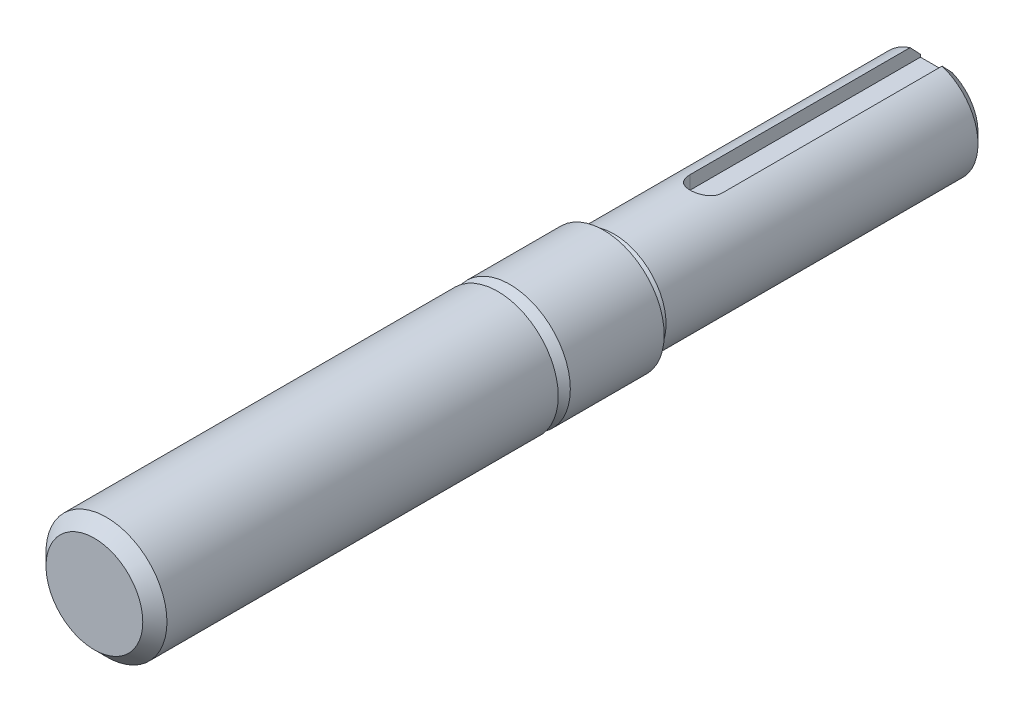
SolidWorks part; units mm, degrees
ref_plane "Front" through (0, 0, 0) normal (0, 0, 1) x (1, 0, 0)
ref_plane "Top" through (0, 0, 0) normal (0, 1, 0) x (1, 0, 0)
ref_plane "Right" through (0, 0, 0) normal (1, 0, 0) x (0, 0, -1)
sketch "Sketch1" plane through (0, 0, 0) normal (1, 0, 0) x (0, 0, -1)
  line L0 (0, 0) -> (65.3053, 0) construction
  line L1 (0, 0) -> (0, 4.8016)
  line L2 (0, 4.8016) -> (1.2004, 6.002)
  line L3 (1.2004, 6.002) -> (40.0304, 6.002)
  line L4 (40.0304, 6.002) -> (40.0304, 4.8016)
  line L5 (40.0304, 4.8016) -> (41.2308, 6.002)
  line L6 (41.2308, 6.002) -> (50.546, 6.002)
  line L7 (50.546, 6.002) -> (50.546, 4.6406)
  line L8 (50.546, 4.6406) -> (51.5772, 5.1562)
  line L9 (51.5772, 5.1562) -> (82.5348, 5.1562)
  line L10 (82.5348, 5.1562) -> (83.566, 4.125)
  line L11 (83.566, 4.125) -> (83.566, 0)
  line L12 (0, 0) -> (83.566, 0)
  dimension "D" = 12.004
  dimension "DChamp1" = 1.2004
  dimension "DChamp2" = 1.2004
  dimension "E" = 40.0304
  dimension "DChamp4" = 1.2004
  dimension "DChamp3" = 1.2004
  dimension "B" = 50.546
  dimension "CChamp1" = 1.0312
  dimension "A" = 83.566
  dimension "CChamp3" = 1.0312
  dimension "CChamp4" = 1.0312
  dimension "C" = 10.3124
  dimension "D2" = 12.004
  dimension "CChamp5" = 9.2812
revolve "Revolve1" add sketch "Sketch1" angle 360 about L0
sketch "Sketch2" plane through (0, 0, -50.546) normal (0, 0, -1) x (-1, 0, 0)
  circle A0 centre (0, 0) radius 53.975
  dimension "D1" = 107.95
extrude "Type123-N" [suppressed] cut sketch "Sketch2" along normal through all
sketch "123KeyDepth" plane through (0, 0, -83.566) normal (0, 0, -1) x (-1, 0, 0)
  line L0 (0, 0) -> (0, 3.5687) construction
  line L1 (-0.5766, 3.5687) -> (0.5714, 3.5687) construction
  dimension "KeyDepth" = 3.5687
ref_plane "123Plane" through (0, 3.5687, 0) normal (0, -1, 0) x (1, 0, 0)
sketch "Sketch4" plane through (0, 3.5687, 0) normal (0, -1, 0) x (1, 0, 0)
  line L0 (0.0026, -83.566) -> (0.0026, -38.0533) construction
  line L1 (0.5766, -83.566) -> (-0.5714, -83.566) construction
  line L2 (1.5901, -83.566) -> (1.5901, -60.706)
  line L3 (-1.5849, -60.706) -> (-1.5849, -83.566)
  line L5 (-3.9689, -60.706) -> (2.9563, -60.706) construction
  line L6 (-4.125, -83.566) -> (4.125, -83.566) construction
  line L7 (-1.5849, -83.566) -> (1.5901, -83.566)
  arc A0 (1.5901, -60.706) -> (-1.5849, -60.706) centre (0.0026, -60.706) ccw
  dimension "F" = 3.175
  dimension "G" = 22.86
extrude "123Key" cut sketch "Sketch4" against normal through all
sketch "Sketch5" plane through (0, 0, -40.0304) normal (0, 0, -1) x (-1, 0, 0)
  circle A0 centre (0, 0) radius 63.5
  dimension "D1" = 127
extrude "Type4" [suppressed] cut sketch "Sketch5" along normal through all
chamfer "Type4-Chamfer" [suppressed] distance 2.54 angle 45
sketch "4KeyDepth" [suppressed] plane through (0, 0, -72.136) normal (0, 0, -1) x (-1, 0, 0)
  line L0 (0, 0) -> (0, 9.525) construction
  line L1 (-17.7759, 9.525) -> (18.3619, 9.525) construction
  dimension "Type4KeyDepth" = 4.732
ref_plane "4Plane" [suppressed] through (0, 9.525, 0) normal (0, -1, 0) x (1, 0, 0)
sketch "Sketch7" [suppressed] plane through (0, 9.525, 0) normal (0, -1, 0) x (1, 0, 0)
  line L0 (-0.293, -72.136) -> (-0.293, -158.7004) construction
  line L1 (17.7759, -72.136) -> (-18.3619, -72.136) construction
  line L2 (2.882, -72.136) -> (2.882, -32.0291)
  line L3 (-3.468, -72.136) -> (-3.468, -32.0291)
  line L4 (-3.468, -72.136) -> (2.882, -72.136)
  line L5 (-10.16, -72.136) -> (10.16, -72.136) construction
  line L6 (-10.16, -72.136) -> (10.16, -72.136) construction
  arc A0 (2.882, -32.0291) -> (-3.468, -32.0291) centre (-0.293, -34.036) ccw
  dimension "4F" = 2.54
  dimension "4G" = 2.54
  dimension "4F2" = 1.27
extrude "4Key" [suppressed] cut sketch "Sketch7" against normal through all
equation "\"DChamp3@Sketch1\"=.1*\"D@Sketch1\""
equation "\"DChamp1@Sketch1\"=.1*\"D@Sketch1\""
equation "\"DChamp2@Sketch1\"=.1*\"D@Sketch1\""
equation "\"DChamp4@Sketch1\"=.1*\"D@Sketch1\""
equation "\"CChamp1@Sketch1\"=.1*\"C@Sketch1\""
equation "\"CChamp5@Sketch1\"=.9*\"C@Sketch1\""
equation "\"CChamp3@Sketch1\"=.1*\"C@Sketch1\""
equation "\"CChamp4@Sketch1\"=.1*\"C@Sketch1\""
equation "\"D2@Sketch1\"=\"D@Sketch1\""
equation "\"KeyDepth@123KeyDepth\"=(\"C@Sketch1\"/2)-(\"F@Sketch4\"/2)"
equation "\"Type4KeyDepth@4KeyDepth\"=(\"D@Sketch1\"/2)-(\"4F@Sketch7\"/2)"
equation "\"4F2@Sketch7\"=\"4F@Sketch7\"/2"
